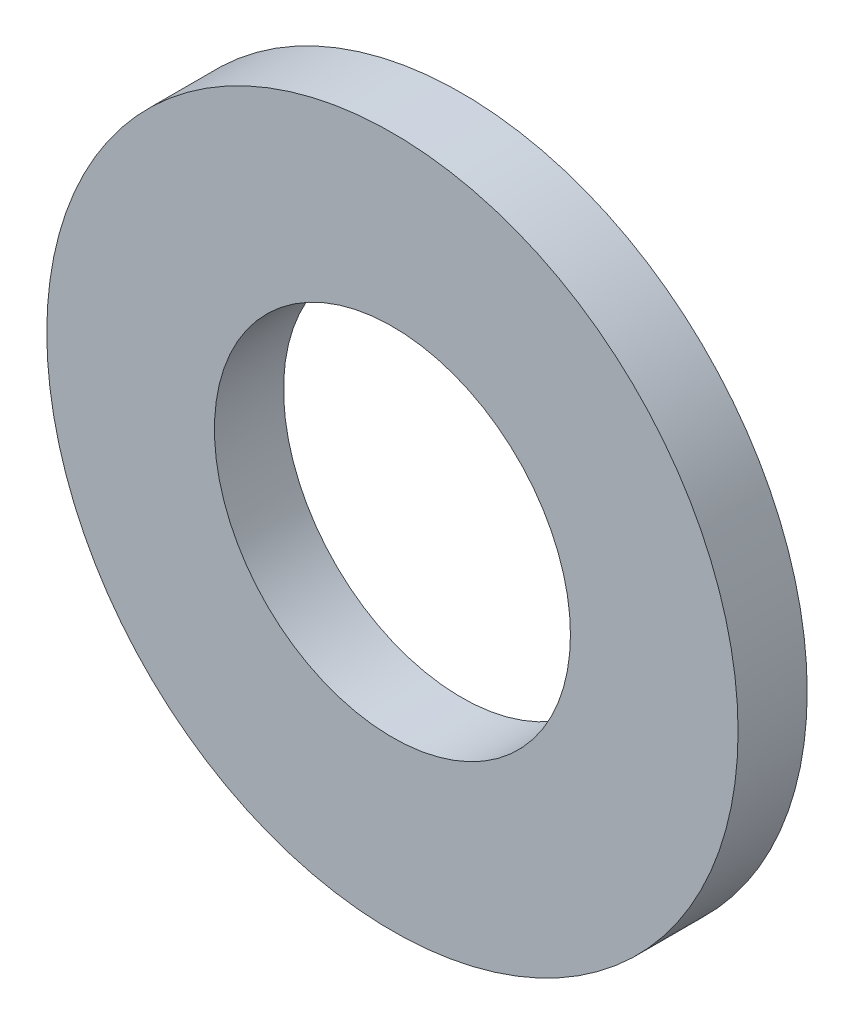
SolidWorks part; units mm, degrees
ref_plane "Спереди" through (0, 0, 0) normal (0, 0, 1) x (1, 0, 0)
ref_plane "Сверху" through (0, 0, 0) normal (0, 1, 0) x (1, 0, 0)
ref_plane "Справа" through (0, 0, 0) normal (1, 0, 0) x (0, 0, -1)
sketch "Эскиз1" plane through (0, 0, 0) normal (0, 0, 1) x (1, 0, 0)
  circle A0 centre (-30.6252, 42.4042) radius 5.15
  circle A1 centre (-30.6252, 42.4042) radius 10
  dimension "D1" = 10.3
  dimension "D2" = 20
extrude "Бобышка-Вытянуть1" add sketch "Эскиз1" along normal blind 2
